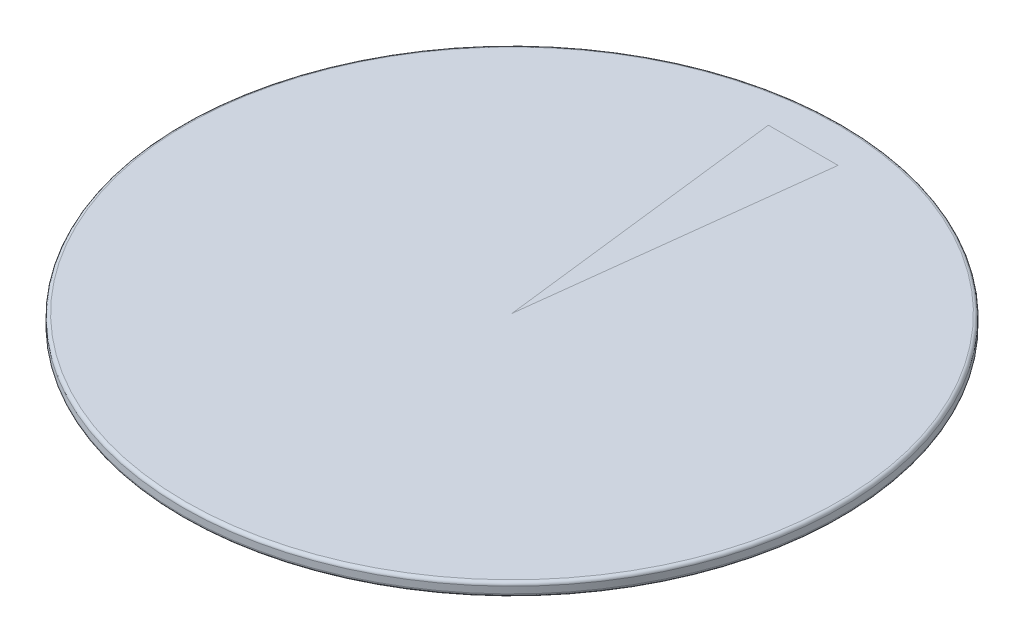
SolidWorks part; units mm, degrees
ref_plane "Front Plane" through (0, 0, 0) normal (0, 0, 1) x (1, 0, 0)
ref_plane "Top Plane" through (0, 0, 0) normal (0, 1, 0) x (1, 0, 0)
ref_plane "Right Plane" through (0, 0, 0) normal (1, 0, 0) x (0, 0, -1)
sketch "Sketch1" plane through (0, 0, 0) normal (0, 1, 0) x (1, 0, 0)
  circle A0 centre (0, 0) radius 25
  dimension "D1" = 50
extrude "Boss-Extrude1" add sketch "Sketch1" along normal blind 1
sketch "Sketch2" plane through (0, 1, 0) normal (0, 1, 0) x (1, 0, 0)
  line L0 (0, 0) -> (-2.6413, 22.09)
  line L1 (-2.6413, 22.09) -> (2.6413, 22.09)
  line L2 (2.6413, 22.09) -> (0, 0)
fillet "Fillet1" radius 0.25 2 edges at (0, 0, 25) (0, 1, 25)
